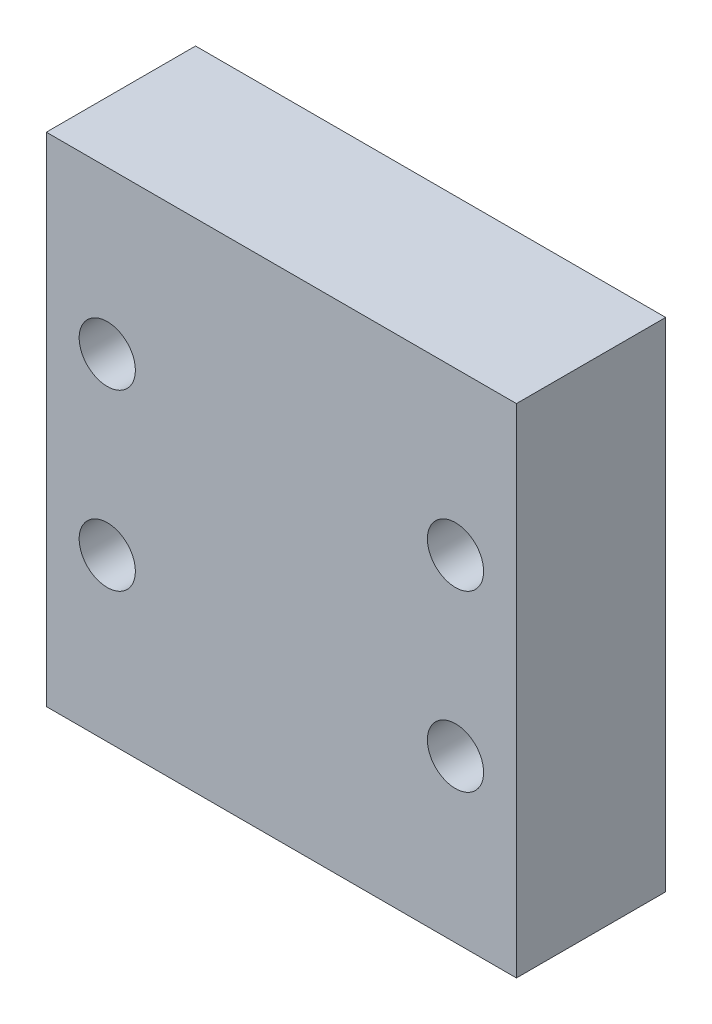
SolidWorks part; units mm, degrees
ref_plane "Front Plane" through (0, 0, 0) normal (0, 0, 1) x (1, 0, 0)
ref_plane "Top Plane" through (0, 0, 0) normal (0, 1, 0) x (1, 0, 0)
ref_plane "Right Plane" through (0, 0, 0) normal (1, 0, 0) x (0, 0, -1)
sketch "Sketch1" plane through (0, 0, 0) normal (0, 0, 1) x (1, 0, 0)
  line L1 (0, 0) -> (18.9, 0)
  line L2 (0, 0) -> (0, 20)
  line L3 (0, 20) -> (18.9, 20)
  line L4 (18.9, 0) -> (18.9, 20)
  circle A0 centre (2.45, 6.5) radius 1.13
  circle A1 centre (2.45, 13.5) radius 1.13
  circle A2 centre (16.45, 13.5) radius 1.13
  circle A3 centre (16.45, 6.5) radius 1.13
  point P13 (0, 0)
  point P14 (0, 0)
  point P15 (0, 0)
  point P16 (0, 0)
  point P17 (0, 0)
  point P18 (0, 0)
  point P19 (0, 0)
  point P20 (0, 0)
  point P21 (0, 0)
  point P22 (0, 0)
  point P23 (0, 0)
  point P24 (0, 0)
  point P25 (0, 0)
  point P26 (0, 0)
extrude "Boss-Extrude1" add sketch "Sketch1" along normal blind 6
